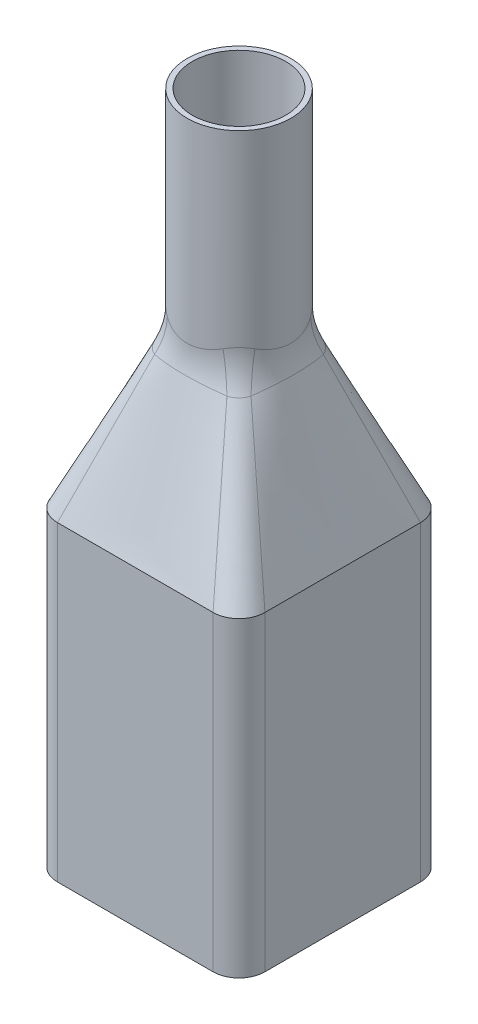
SolidWorks part; units mm, degrees
ref_plane "Plane1" through (0, 0, 0) normal (0, 0, 1) x (1, 0, 0)
ref_plane "Plane2" through (0, 0, 0) normal (0, 1, 0) x (1, 0, 0)
ref_plane "Plane3" through (0, 0, 0) normal (1, 0, 0) x (0, 0, -1)
ref_plane "Plane4" through (0, 90, 0) normal (0, 1, 0) x (-1, 0, 0)
sketch "Sketch1" plane through (0, 0, 0) normal (0, 1, 0) x (1, 0, 0)
  line L0 (-20, 20) -> (20, -20) construction
  line L1 (-20, 20) -> (20, 20)
  line L2 (-20, 20) -> (-20, -20)
  line L3 (-20, -20) -> (20, -20)
  line L4 (20, 20) -> (20, -20)
  dimension "D1" = 40
sketch "Sketch3" plane through (0, 90, 0) normal (0, 1, 0) x (-1, 0, 0)
  circle A1 centre (0, 0) radius 10
  dimension "D1" = 20
extrude "block" add sketch "Sketch1" along normal blind 60
fillet "block-fillet" radius 5 4 edges at (-20, 30, -20) (20, 30, -20) (20, 30, 20) (-20, 30, 20)
sketch "Sketch2" plane through (0, 60, 0) normal (0, 1, 0) x (-1, 0, 0)
  line L4 (15, 20) -> (-15, 20)
  line L5 (-20, 15) -> (-20, -15)
  line L6 (-15, -20) -> (15, -20)
  line L7 (20, -15) -> (20, 15)
  line L8 (15, 20) -> (-15, 20)
  line L9 (-20, 15) -> (-20, -15)
  line L10 (-15, -20) -> (15, -20)
  line L11 (20, -15) -> (20, 15)
  arc A4 (-15, 20) -> (-20, 15) centre (-15, 15) ccw
  arc A5 (-20, -15) -> (-15, -20) centre (-15, -15) ccw
  arc A6 (15, -20) -> (20, -15) centre (15, -15) ccw
  arc A7 (20, 15) -> (15, 20) centre (15, 15) ccw
  arc A8 (-15, 20) -> (-20, 15) centre (-15, 15) ccw
  arc A9 (-20, -15) -> (-15, -20) centre (-15, -15) ccw
  arc A10 (15, -20) -> (20, -15) centre (15, -15) ccw
  arc A11 (20, 15) -> (15, 20) centre (15, 15) ccw
  dimension "D1" = 0
loft "shoulder" add profiles "Sketch3", "Sketch2"
sketch "Sketch4" plane through (0, 90, 0) normal (0, 1, 0) x (-1, 0, 0)
  arc A8 (-8, 6) -> (-8, -6) centre (0, 0) ccw
  arc A9 (-8, -6) -> (-6, -8) centre (0, 0) ccw
  arc A10 (-6, -8) -> (6, -8) centre (0, 0) ccw
  arc A11 (6, -8) -> (8, -6) centre (0, 0) ccw
  arc A12 (8, -6) -> (8, 6) centre (0, 0) ccw
  arc A13 (8, 6) -> (6, 8) centre (0, 0) ccw
  arc A14 (6, 8) -> (-6, 8) centre (0, 0) ccw
  arc A15 (-6, 8) -> (-8, 6) centre (0, 0) ccw
  arc A16 (-8, 6) -> (-8, -6) centre (0, 0) ccw
  arc A17 (-8, -6) -> (-6, -8) centre (0, 0) ccw
  arc A18 (-6, -8) -> (6, -8) centre (0, 0) ccw
  arc A19 (6, -8) -> (8, -6) centre (0, 0) ccw
  arc A20 (8, -6) -> (8, 6) centre (0, 0) ccw
  arc A21 (8, 6) -> (6, 8) centre (0, 0) ccw
  arc A22 (6, 8) -> (-6, 8) centre (0, 0) ccw
  arc A23 (-6, 8) -> (-8, 6) centre (0, 0) ccw
  dimension "D1" = 0
extrude "neck" add sketch "Sketch4" along normal blind 40
fillet "neck-fillet" radius 15 12 edges
shell "Shell1" thickness 1
